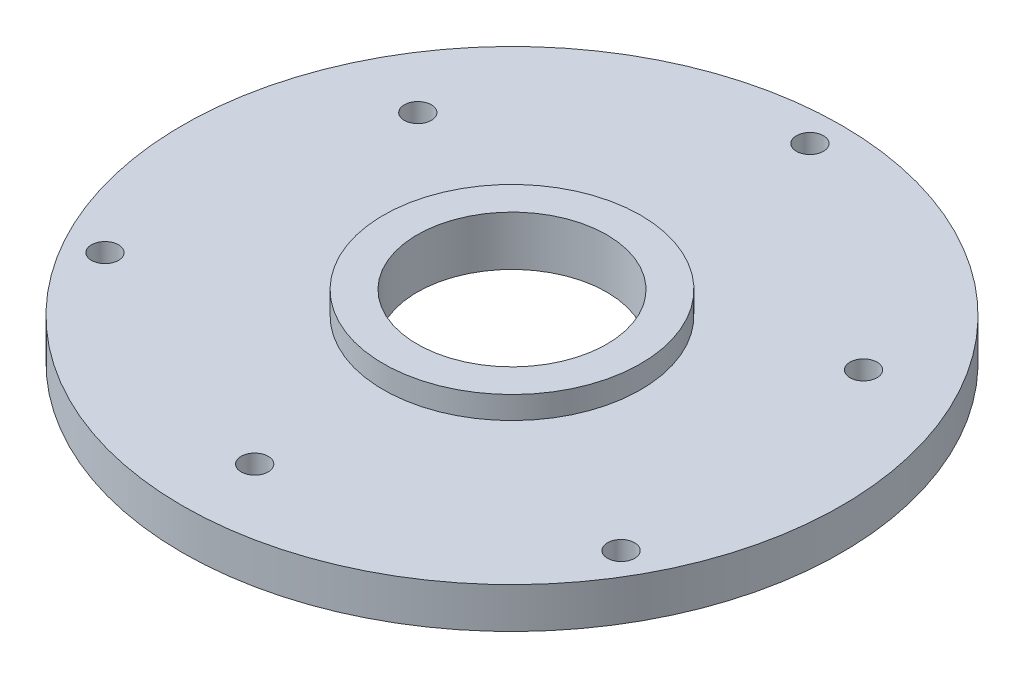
SolidWorks part; units mm, degrees
ref_plane "Piano frontale" through (0, 0, 0) normal (0, 0, 1) x (1, 0, 0)
ref_plane "Piano superiore" through (0, 0, 0) normal (0, 1, 0) x (1, 0, 0)
ref_plane "Piano destro" through (0, 0, 0) normal (1, 0, 0) x (0, 0, -1)
sketch "Schizzo1" plane through (0, 0, 0) normal (0, 0, 1) x (1, 0, 0)
  line L0 (0, 0) -> (0, 68.8521) construction
  line L4 (36.5, 38.8859) -> (36.5, 34.3859)
  line L10 (17.5, 34.3859) -> (36.5, 34.3859)
  line L11 (17.5, 34.3859) -> (17.5, 35.8859)
  line L12 (17.5, 35.8859) -> (10.5, 35.8859)
  line L15 (10.5, 41.3859) -> (14.25, 41.3859)
  line L16 (14.25, 41.3859) -> (14.25, 38.8859)
  line L17 (10.5, 35.8859) -> (10.5, 41.3859)
  line L18 (14.25, 38.8859) -> (36.5, 38.8859)
  dimension "D1" = 14.25
  dimension "D2" = 36.5
  dimension "D3" = 1.5
  dimension "D4" = 2.5
  dimension "D5" = 10.5
  dimension "D6" = 4.5
  dimension "D7" = 17.5
revolve "Rivoluzione1" add sketch "Schizzo1" angle 360 about L0
sketch "Schizzo2" plane through (0, 38.8859, 0) normal (0, 1, 0) x (1, 0, 0)
  circle A0 centre (0, 33) radius 1.5
  circle A1 centre (28.5788, -16.5) radius 1.5
  circle A2 centre (-28.5788, -16.5) radius 1.5
  point P10 (0, 0)
  dimension "D1" = 3
  dimension "D2" = 33
  dimension "D3" = 3
extrude "Taglio-Estrusione1" cut sketch "Schizzo2" against normal through all
sketch "Schizzo6" plane through (0, 34.3859, 0) normal (0, -1, 0) x (-1, 0, 0)
  circle A0 centre (0, -28.5) radius 1.5
  circle A1 centre (-24.6817, 14.25) radius 1.5
  circle A2 centre (24.6817, 14.25) radius 1.5
  point P10 (0, 0)
  dimension "D1" = 28.5
  dimension "D3" = 3
  dimension "D2" = 3
extrude "Taglio-Estrusione3" cut sketch "Schizzo6" against normal through all contours A1
